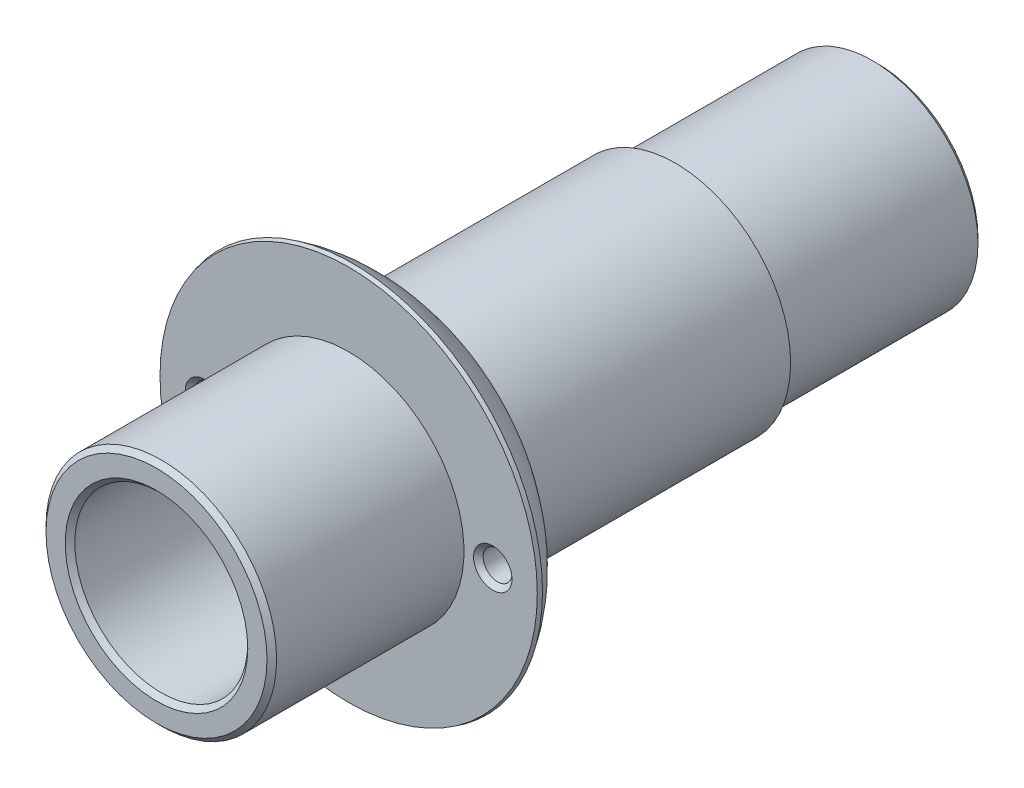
SolidWorks part; units mm, degrees
ref_plane "Спереди" through (0, 0, 0) normal (0, 0, 1) x (1, 0, 0)
ref_plane "Сверху" through (0, 0, 0) normal (0, 1, 0) x (1, 0, 0)
ref_plane "Справа" through (0, 0, 0) normal (1, 0, 0) x (0, 0, -1)
sketch "Эскиз1" plane through (0, 0, 0) normal (1, 0, 0) x (0, 0, -1)
  line L0 (1.25, 4.5) -> (-1.25, 4.5)
  line L1 (-1.25, 4.5) -> (-1.25, 10)
  line L2 (-1.25, 0) -> (1.25, 0) construction
  line L3 (1.25, 4.5) -> (1.25, 7.5316)
  arc A0 (1.25, 7.5316) -> (-1.25, 10) centre (-4.55, 4.1576) ccw
  dimension "D4" = 3.3
  dimension "D5" = 13.42
  dimension "D1" = 20
  dimension "D2" = 9
  dimension "D3" = 2.5
revolve "Повернуть1" add sketch "Эскиз1" angle 360 about L2
sketch "Эскиз2" plane through (0, 0, 1.25) normal (0, 0, 1) x (1, 0, 0)
  line L0 (-7.5, 0) -> (0, 0) construction
  line L1 (0, 0) -> (7.5, 0) construction
  circle A0 centre (-7.5, 0) radius 0.75
  circle A1 centre (7.5, 0) radius 0.75
  dimension "D1" = 1.5
  dimension "D2" = 15
extrude "Вырез-Вытянуть1" cut sketch "Эскиз2" against normal blind 1.5
sketch "Эскиз3" plane through (0, 0, 1.25) normal (0, 0, 1) x (1, 0, 0)
  circle A0 centre (0, 0) radius 6
  circle A1 centre (0, 0) radius 4.5 construction
  circle A2 centre (0, 0) radius 4.5
  dimension "D1" = 12
extrude "Бобышка-Вытянуть1" add sketch "Эскиз3" along normal blind 10
sketch "Эскиз4" plane through (0, 0, -1.25) normal (0, 0, -1) x (-1, 0, 0)
  circle A0 centre (0, 0) radius 6 construction
  circle A1 centre (0, 0) radius 6
  circle A2 centre (0, 0) radius 4.5 construction
  circle A3 centre (0, 0) radius 4.5
extrude "Бобышка-Вытянуть2" add sketch "Эскиз4" along normal blind 14.5
sketch "Эскиз5" plane through (0, 0, -15.75) normal (0, 0, -1) x (-1, 0, 0)
  circle A0 centre (0, 0) radius 4.5 construction
  circle A1 centre (0, 0) radius 4.5
  circle A2 centre (0, 0) radius 5.5
  dimension "D1" = 11
extrude "Бобышка-Вытянуть3" add sketch "Эскиз5" along normal blind 10.5
chamfer "Фаска1" distance 0.25 angle 45 9 edges at (-6.75, 0, 1.25) (-6.75, 0, -0.25) (8.25, 0, 1.25) (8.25, 0, -0.25) (-4.5, 0, -26.25) (4.5, 0, 11.25) (10, 0, 1.25) (-5.5, 0, -26.25) (6, 0, 11.25)
